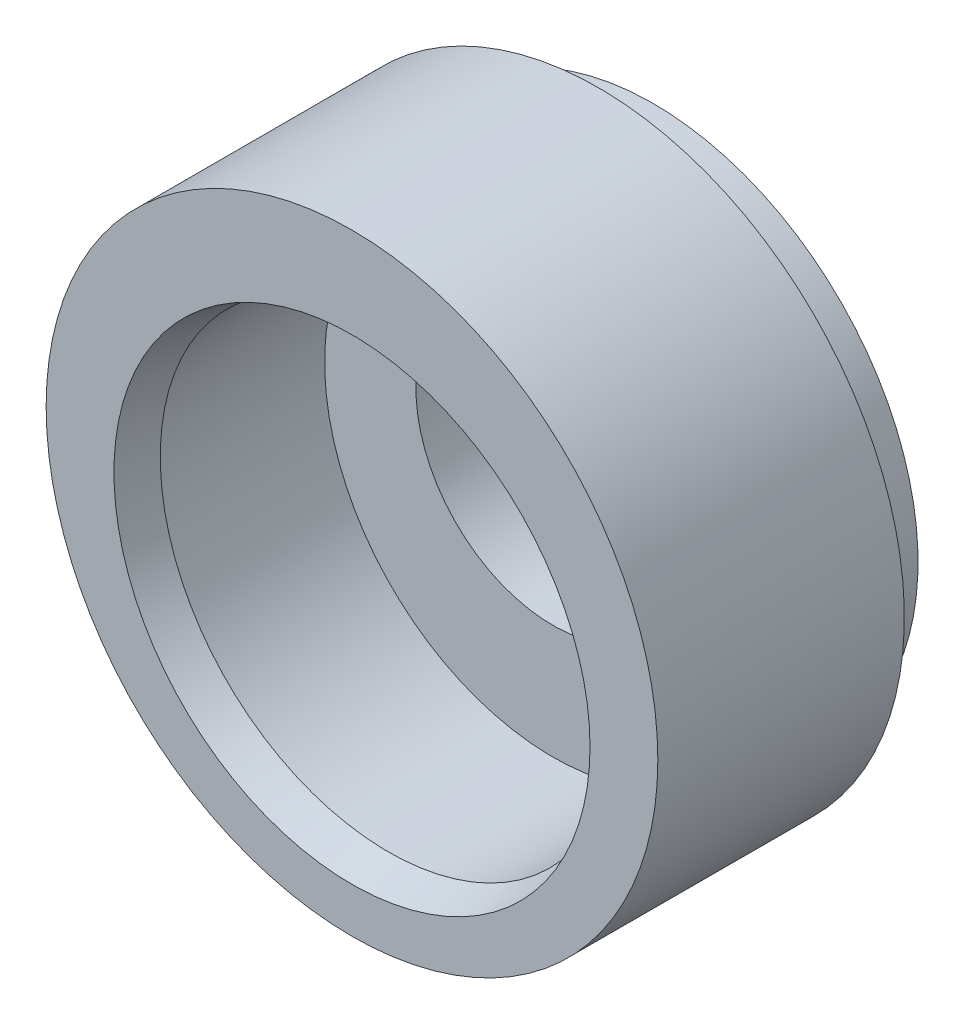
SolidWorks part; units mm, degrees
ref_plane "Plane1" through (0, 0, 0) normal (0, 0, 1) x (1, 0, 0)
ref_plane "Plane2" through (0, 0, 0) normal (0, 1, 0) x (1, 0, 0)
ref_plane "Plane3" through (0, 0, 0) normal (1, 0, 0) x (0, 0, -1)
sketch "Sketch1" plane through (0, 0, 0) normal (0, 0, 1) x (1, 0, 0)
  circle A0 centre (0, 0) radius 8.509
  circle A1 centre (0, 0) radius 3.81
  dimension "D1" = 17.018
  dimension "D2" = 7.62
extrude "Base-Extrude" add sketch "Sketch1" along normal blind 8.382
sketch "Sketch2" plane through (0, 0, 8.382) normal (0, 0, 1) x (1, 0, 0)
  circle A0 centre (0, -0.635) radius 6.35
  dimension "D1" = 0.635
  dimension "D2" = 12.7
extrude "offset_hole" cut sketch "Sketch2" against normal blind 5.588
sketch "Sketch3" plane through (0, 0, 0) normal (0, 0, -1) x (-1, 0, 0)
  circle A0 centre (0, 0) radius 7.366
  dimension "D1" = 14.732
extrude "Cut-Extrude2" cut sketch "Sketch3" against normal blind 1.524 flip side to cut
chamfer "Chamfer1" distance 1.016 angle 15 1 edges at (6.35, -0.635, 8.382)
